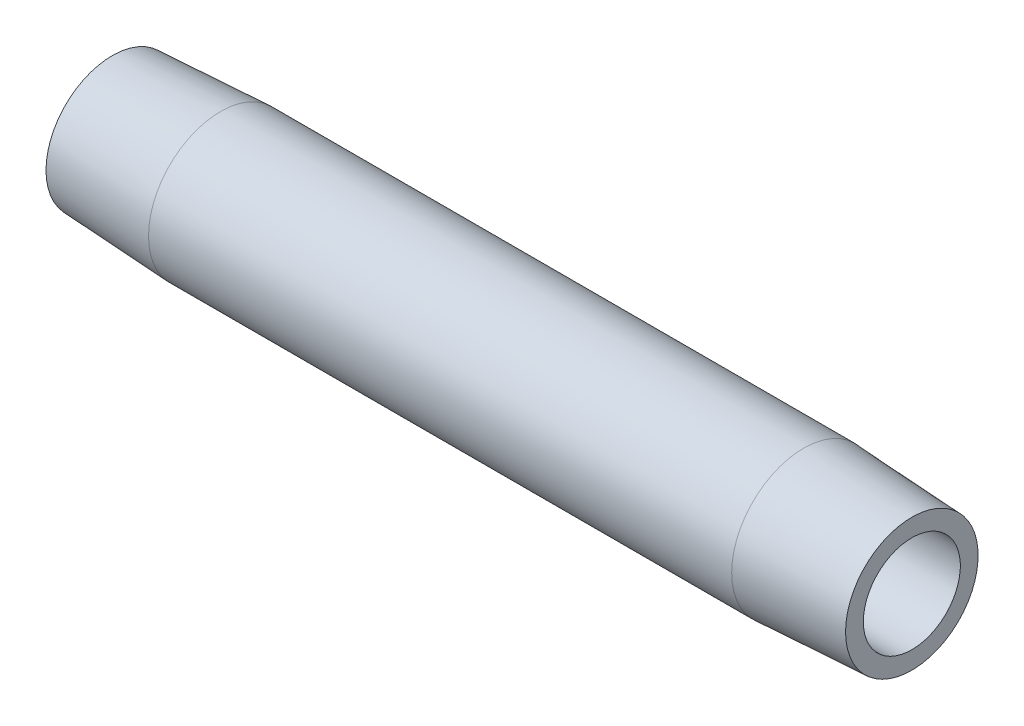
SolidWorks part; units mm, degrees
ref_plane "Front Plane" through (0, 0, 0) normal (0, 0, 1) x (1, 0, 0)
ref_plane "Top Plane" through (0, 0, 0) normal (0, 1, 0) x (1, 0, 0)
ref_plane "Right Plane" through (0, 0, 0) normal (1, 0, 0) x (0, 0, -1)
sketch "Sketch1" plane through (0, 0, 0) normal (0, 1, 0) x (1, 0, 0)
  line L6 (76.2, 4.6228) -> (0, 4.6228)
  line L7 (10.3124, 6.858) -> (0, 6.3175)
  line L8 (0, 6.3175) -> (0, 4.6228)
  line L9 (65.8876, 6.858) -> (10.3124, 6.858)
  line L10 (76.2, 6.3175) -> (65.8876, 6.858)
  line L11 (76.2, 4.6228) -> (76.2, 6.3175)
  line L12 (-6.376, 0) -> (49993.624, 0) construction
  dimension "D1" = 9.2456
  dimension "D2" = 13.716
  dimension "D3" = 3
  dimension "D4" = 3
  dimension "D5" = 76.2
  dimension "D6" = 10.3124
  dimension "D7" = 10.3124
revolve "Revolve1" add sketch "Sketch1" angle 360 about L12
